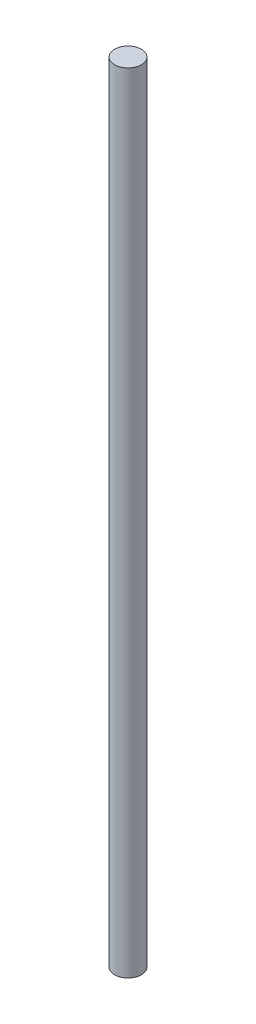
SolidWorks part; units mm, degrees
ref_plane "Front" through (0, 0, 0) normal (0, 0, 1) x (1, 0, 0)
ref_plane "Top" through (0, 0, 0) normal (0, 1, 0) x (1, 0, 0)
ref_plane "Right" through (0, 0, 0) normal (1, 0, 0) x (0, 0, -1)
sketch "Sketch1" plane through (0, 0, 0) normal (0, 1, 0) x (1, 0, 0)
  circle A0 centre (0, 0) radius 4.7625
  dimension "D1" = 9.525
extrude "Extrude1" add sketch "Sketch1" along normal blind 279.4
